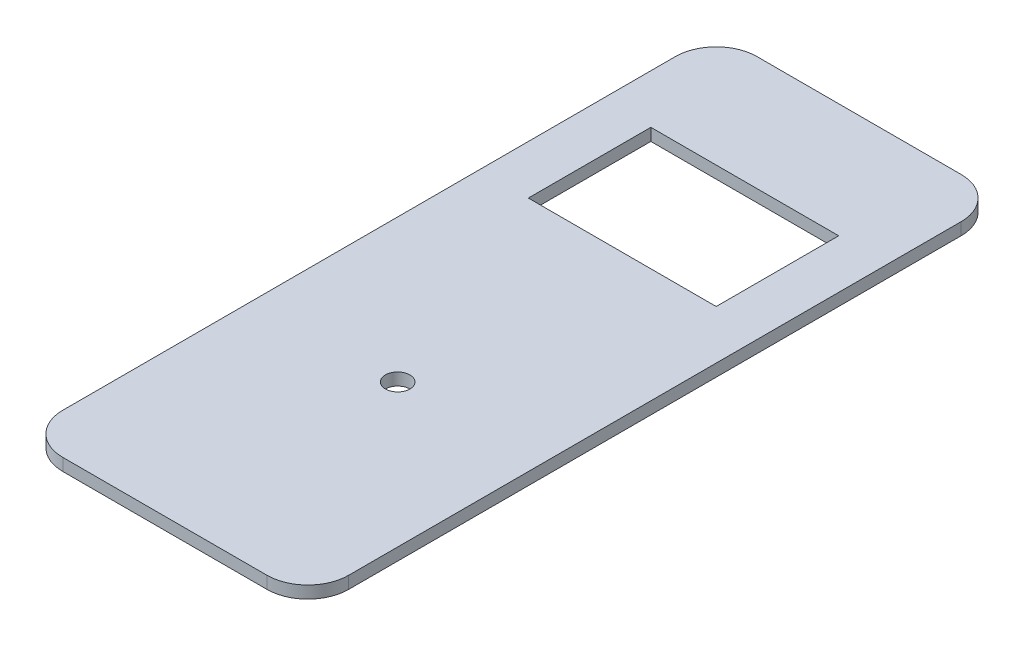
SolidWorks part; units mm, degrees
ref_plane "Ebene vorne" through (0, 0, 0) normal (0, 0, 1) x (1, 0, 0)
ref_plane "Ebene oben" through (0, 0, 0) normal (0, 1, 0) x (1, 0, 0)
ref_plane "Ebene rechts" through (0, 0, 0) normal (1, 0, 0) x (0, 0, -1)
sketch "Skizze1" plane through (0, 0, 0) normal (0, 1, 0) x (1, 0, 0)
  line L0 (0, 73.1806) -> (0, -54.6415) construction
  line L2 (-17.5, 0) -> (17.5, 0)
  line L3 (-17.5, 0) -> (-17.5, -85)
  line L4 (-17.5, -85) -> (17.5, -85)
  line L5 (17.5, 0) -> (17.5, -85)
  line L6 (-11.5, -14) -> (11.5, -14)
  line L7 (-11.5, -14) -> (-11.5, -29)
  line L8 (-11.5, -29) -> (11.5, -29)
  line L9 (11.5, -14) -> (11.5, -29)
  circle A0 centre (0, -56.5) radius 1.5
  dimension "D6" = 3
  dimension "D1" = 35
  dimension "D2" = 85
  dimension "D3" = 14
  dimension "D4" = 15
  dimension "D5" = 23
  dimension "D7" = 28.5
extrude "Aufsatz-Linear austragen1" add sketch "Skizze1" along normal blind 1.5
fillet "Verrundung1" radius 5 4 edges at (17.5, 0.75, 0) (-17.5, 0.75, 0) (-17.5, 0.75, 85) (17.5, 0.75, 85)
